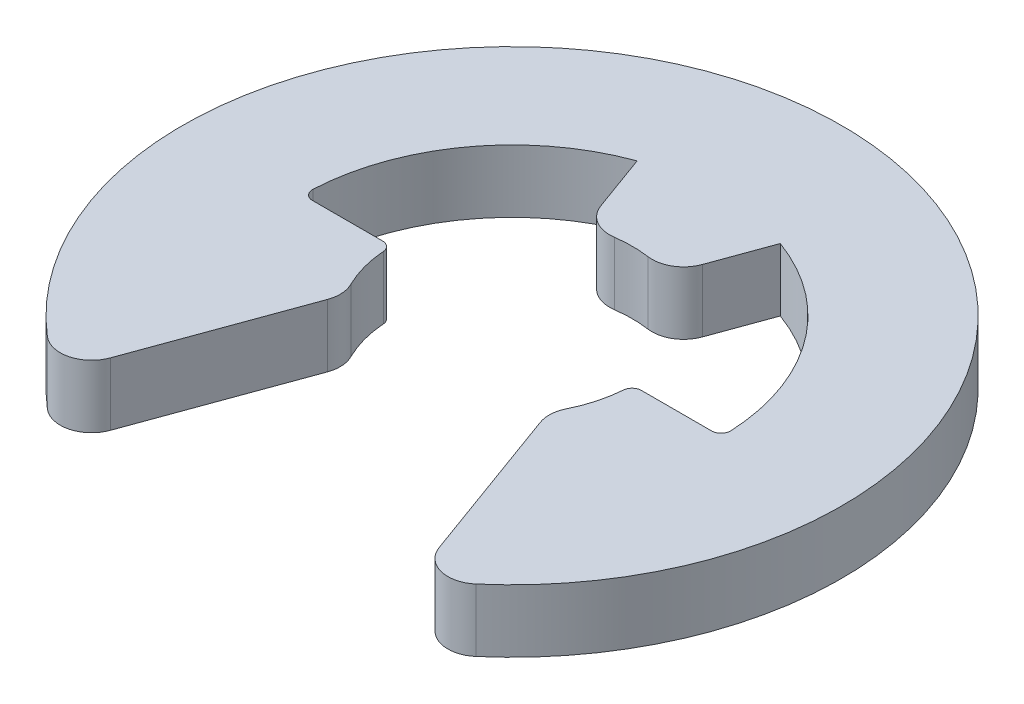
SolidWorks part; units mm, degrees
ref_plane "Front Plane" through (0, 0, 0) normal (0, 0, 1) x (1, 0, 0)
ref_plane "Top Plane" through (0, 0, 0) normal (0, 1, 0) x (1, 0, 0)
ref_plane "Right Plane" through (0, 0, 0) normal (1, 0, 0) x (0, 0, -1)
sketch "Sketch2" plane through (0, 0, 0) normal (0, 1, 0) x (1, 0, 0)
  line L0 (-1.7084, -2.6465) -> (-0.97, -0.6177)
  line L2 (0.97, -0.6177) -> (1.7084, -2.6465)
  line L4 (-1.15, 0) -> (-2, 0)
  line L5 (1.15, 0) -> (2, 0)
  line L6 (-0.684, 1.8794) -> (-0.3933, 1.0806)
  line L8 (0.3933, 1.0806) -> (0.684, 1.8794)
  arc A0 (1.7084, -2.6465) -> (-1.7084, -2.6465) centre (0, 0) ccw
  arc A1 (0.97, -0.6177) -> (1.15, 0) centre (0, 0) ccw
  arc A2 (2, 0) -> (0.684, 1.8794) centre (0, 0) ccw
  arc A3 (-1.15, 0) -> (-0.97, -0.6177) centre (0, 0) ccw
  arc A4 (0.3933, 1.0806) -> (-0.3933, 1.0806) centre (0, 0) ccw
  arc A5 (-0.684, 1.8794) -> (-2, 0) centre (0, 0) ccw
  point P15 (0, 0)
  point P16 (0, 1.15)
  dimension "D1" = 6.3
  dimension "D2" = 2.3
  dimension "D3" = 4
  dimension "D4" = 70
  dimension "D5" = 70
  dimension "D6" = 1.94
  dimension "D7" = 40
extrude "Boss-Extrude1" add sketch "Sketch2" along normal mid plane 0.6
fillet "Fillet1" radius 0.3 6 edges at (0.97, 0, 0.6177) (-0.97, 0, 0.6177) (0.3933, 0, -1.0806) (-0.3933, 0, -1.0806) (1.7084, 0, 2.6465) (-1.7084, 0, 2.6465)
fillet "Fillet2" radius 0.09 4 edges at (2, 0, 0) (1.15, 0, 0) (-2, 0, 0) (-1.15, 0, 0)
